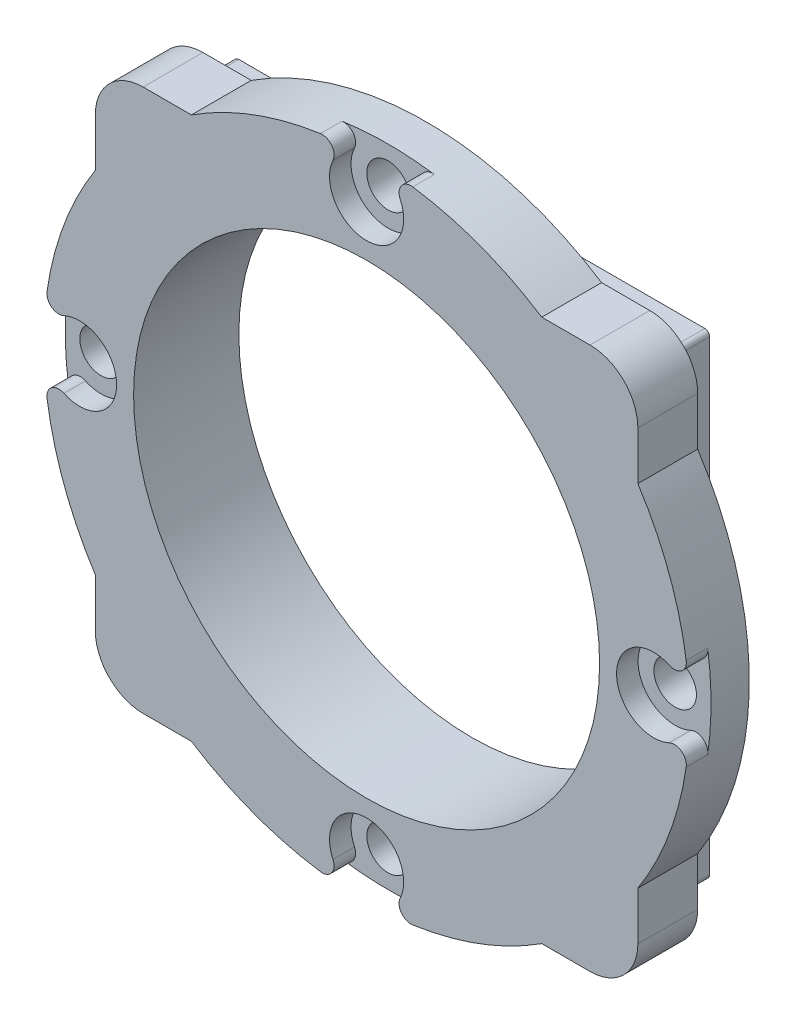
SolidWorks part; units mm, degrees
ref_plane "Front Plane" through (0, 0, 0) normal (0, 0, 1) x (1, 0, 0)
ref_plane "Top Plane" through (0, 0, 0) normal (0, 1, 0) x (1, 0, 0)
ref_plane "Right Plane" through (0, 0, 0) normal (1, 0, 0) x (0, 0, -1)
sketch "Sketch1" plane through (0, 0, 0) normal (0, 0, 1) x (1, 0, 0)
  circle A0 centre (0, 0) radius 12.7
  dimension "D1" = 25.4
extrude "Boss-Extrude1" add sketch "Sketch1" along normal blind 6.35
sketch "Sketch2" plane through (0, 0, 6.35) normal (0, 0, 1) x (1, 0, 0)
  circle A0 centre (0, 0) radius 17.145
  dimension "D1" = 34.29
extrude "Boss-Extrude2" add sketch "Sketch2" along normal blind 44.45
sketch "Sketch3" plane through (0, 0, 50.8) normal (0, 0, 1) x (1, 0, 0)
  circle A0 centre (0, 0) radius 12.5
  dimension "D1" = 25
extrude "Cut-Extrude1" cut sketch "Sketch3" against normal blind 31.75
ref_plane "Plane1" through (0, 25.4, 0) normal (0, 1, 0) x (1, 0, 0)
sketch "Sketch5" plane through (0, 0, 50.8) normal (0, 0, 1) x (1, 0, 0)
  line L1 (-12.625, 12.625) -> (12.625, 12.625)
  line L2 (-12.625, 12.625) -> (-12.625, -12.625)
  line L3 (-12.625, -12.625) -> (12.625, -12.625)
  line L4 (12.625, 12.625) -> (12.625, -12.625)
  line L5 (-12.625, 12.625) -> (12.625, -12.625) construction
  line L6 (-12.625, -12.625) -> (12.625, 12.625) construction
  point P0 (0, 0)
  dimension "D1" = 25.25
  dimension "D2" = 25.25
extrude "Cut-Extrude3" cut sketch "Sketch5" against normal blind 38.1
sketch "Sketch11" plane through (0, 0, 50.8) normal (0, 0, 1) x (1, 0, 0)
  circle A0 centre (0, 0) radius 17.145
extrude "Cut-Extrude5" cut sketch "Sketch11" against normal blind 0.6627
sketch "Sketch10" plane through (12.625, 0, 0) normal (-1, 0, 0) x (0, 0, 1)
  line L0 (19.5664, 12.625) -> (45.9656, -12.625)
  line L1 (12.7, 12.625) -> (50.1373, 12.625) construction
  line L2 (50.1373, -12.625) -> (12.7, -12.625) construction
  line L3 (45.9656, -12.625) -> (18.8617, -12.625)
  line L5 (19.5664, 12.625) -> (12.7, 12.625)
  line L6 (12.7, 12.625) -> (12.7, -12.625)
  line L7 (12.7, -12.625) -> (45.9656, -12.625)
  point P6 (32.766, 0)
  dimension "D1" = 32.766
extrude "Boss-Extrude4" add sketch "Sketch10" along normal up to surface (25.25 mm away) contours L0 M8 M9 M10 | L5 L6 L0 M8 | L6 L7 L3 L0 M10
sketch "Sketch4" plane through (0, 25.4, 0) normal (0, 1, 0) x (1, 0, 0)
  circle A0 centre (0, -33.02) radius 12.5
  dimension "D1" = 25
  dimension "D2" = 33.02
extrude "Cut-Extrude2" cut sketch "Sketch4" against normal blind 13.7012
sketch "Sketch12" plane through (0, 0, 50.1373) normal (0, 0, 1) x (1, 0, 0)
  line L0 (-11.6, 12.625) -> (11.6, 12.625) construction
  line L1 (-14.403, 14.403) -> (14.403, 14.403)
  line L2 (-14.403, 14.403) -> (-14.403, -14.403)
  line L3 (-14.403, -14.403) -> (14.403, -14.403)
  line L4 (14.403, 14.403) -> (14.403, -14.403)
  line L5 (-14.403, 14.403) -> (14.403, -14.403) construction
  line L6 (-14.403, -14.403) -> (14.403, 14.403) construction
  line L8 (-12.625, -12.625) -> (12.625, -12.625)
  line L9 (-12.625, -12.625) -> (-12.625, 12.625)
  line L10 (-12.625, 12.625) -> (12.625, 12.625)
  line L11 (12.625, -12.625) -> (12.625, 12.625)
  line L12 (-12.625, -12.625) -> (12.625, 12.625) construction
  line L13 (-12.625, 12.625) -> (12.625, -12.625) construction
  point P0 (0, 0)
  point P8 (0, 0)
  dimension "D1" = 1.778
  dimension "D2" = 1.778
extrude "Boss-Extrude5" add sketch "Sketch12" against normal blind 33.6318
fillet "Fillet3" radius 2.54 4 edges at (-14.403, -14.403, 33.3214) (14.403, -14.403, 33.3214) (14.403, 14.403, 33.3214) (-14.403, 14.403, 33.3214)
sketch "Sketch6" plane through (0, 0, 0) normal (0, 0, -1) x (-1, 0, 0)
  circle A0 centre (0, 0) radius 9.525
  dimension "D1" = 19.05
combine bodies "Combine1" operation type add bodies to combine 125 121
sketch "Sketch14" plane through (0, 14.403, 0) normal (0, 1, 0) x (1, 0, 0)
  circle A0 centre (0, -33.02) radius 12.5
  dimension "D2" = 25
  dimension "D1" = 33.02
extrude "Cut-Extrude7" cut sketch "Sketch14" against normal up to surface (1.778 mm away)
extrude "Cut-Extrude8" cut sketch "Sketch6" against normal blind 72.644
sketch "Sketch15" plane through (0, 0, 50.1373) normal (0, 0, 1) x (1, 0, 0)
  line L9 (-11.43, 11.43) -> (11.43, 11.43)
  line L10 (-11.43, 11.43) -> (-11.43, -11.43)
  line L11 (-11.43, -11.43) -> (11.43, -11.43)
  line L12 (11.43, 11.43) -> (11.43, -11.43)
  line L13 (-11.43, 11.43) -> (11.43, -11.43) construction
  line L14 (-11.43, -11.43) -> (11.43, 11.43) construction
  point P0 (0, 0)
  dimension "D1" = 22.86
  dimension "D2" = 22.86
extrude "Cut-Extrude9" cut sketch "Sketch15" against normal blind 34.798
fillet "Fillet6" radius 1.27 4 edges at (11.43, 0, 15.3393) (0, -11.43, 15.3393) (-11.43, 0, 15.3393) (0, 11.43, 15.3393)
sketch "Sketch16" plane through (0, 0, 0) normal (0, 0, -1) x (-1, 0, 0)
  circle A0 centre (0, 0) radius 23.7869
extrude "Cut-Extrude10" cut sketch "Sketch16" against normal offset from surface (46.9623 mm away) 3.175
sketch "Sketch17" plane through (0, 0, 50.1373) normal (0, 0, 1) x (1, 0, 0)
  line L11 (12.625, -12.625) -> (-12.625, -12.625)
  line L12 (12.625, -12.625) -> (12.625, 12.625)
  line L13 (12.625, 12.625) -> (-12.625, 12.625)
  line L14 (12.371, -12.371) -> (12.371, 12.371)
  line L15 (-12.371, -12.371) -> (12.371, -12.371)
  line L16 (-12.371, 12.371) -> (-12.371, -12.371)
  line L17 (12.371, 12.371) -> (-12.371, 12.371)
  line L18 (12.371, -12.371) -> (12.371, 12.371)
  line L19 (-12.371, -12.371) -> (12.371, -12.371)
  line L20 (-12.371, 12.371) -> (-12.371, -12.371)
  line L21 (12.371, 12.371) -> (-12.371, 12.371)
  line L22 (-12.625, -12.625) -> (-12.625, 12.625)
  line L23 (12.625, -12.625) -> (-12.625, 12.625) construction
  line L24 (12.625, 12.625) -> (-12.625, -12.625) construction
  point P0 (0, 0)
  dimension "D1" = 0.254
extrude "Boss-Extrude6" add sketch "Sketch17" against normal offset from surface (5.588 mm away) 2.413 separate body
combine bodies "Combine2" operation type add bodies to combine 129 130
fillet "Fillet7" radius 0.254 4 edges at (12.625, -12.625, 45.7558) (-12.625, -12.625, 45.7558) (-12.625, 12.625, 45.7558) (12.625, 12.625, 45.7558)
hole_wizard "#2 Clearance Hole1" positions "Sketch22" profile "Sketch23" hole size "#2" standard "ANSI Inch"
sketch "Sketch22" plane through (0, 0, 50.1373) normal (0, 0, 1) x (1, 0, 0)
  point P0 (0, 15.24)
  point P2 (15.24, 0)
  point P4 (0, -15.24)
  point P6 (-15.24, 0)
  dimension "D1" = 15.24
  dimension "D2" = 15.24
  dimension "D3" = 15.24
  dimension "D4" = 15.24
sketch "Sketch23" plane through (0, 15.24, 50.1373) normal (1, 0, 0) x (0, -1, 0)
  line L0 (0, 0) -> (0, 13.3792)
  line L1 (0, 13.3792) -> (1.1303, 12.7)
  line L2 (1.1303, 12.7) -> (1.1303, 0)
  line L5 (1.1303, 0) -> (0, 0)
  line L10 (0, 13.3792) -> (-1.1303, 12.7) construction
  line L11 (0, -6.35) -> (0, 107.95) construction
  dimension "Hole Dia." = 2.2606
  dimension "Hole Depth" = 12.7
  dimension "Drill Angle" = 118
sketch "Sketch24" plane through (0, 0, 50.1373) normal (0, 0, 1) x (1, 0, 0)
  line L1 (-12.6238, 12.7153) -> (12.6238, 12.7153)
  line L2 (-12.6238, 12.7153) -> (-12.6238, -12.7153)
  line L3 (-12.6238, -12.7153) -> (12.6238, -12.7153)
  line L4 (12.6238, 12.7153) -> (12.6238, -12.7153)
  line L5 (-12.6238, 12.7153) -> (12.6238, -12.7153) construction
  line L6 (-12.6238, -12.7153) -> (12.6238, 12.7153) construction
  circle A0 centre (0, 0) radius 12.6238
  dimension "D1" = 25.2476
  dimension "D2" = 25.2476
extrude "Boss-Extrude7" add sketch "Sketch24" against normal up to surface (5.588 mm away) contours A0 M23 M22 | A0 M24 M23 | A0 M21 M24 | A0 M22 M21 | L2 L1 L4 L3
sketch "Sketch25" plane through (0, 0, 50.1373) normal (0, 0, 1) x (1, 0, 0)
  circle A0 centre (0, 15.24) radius 1.9685
  dimension "D1" = 3.937
extrude "Cut-Extrude12" cut sketch "Sketch25" against normal blind 1.143
fillet "Fillet8" radius 0.635 2 edges at (-0.526, 17.1369, 49.5658) (0.526, 17.1369, 49.5658)
pattern_circular "CirPattern1" count 4 over 360 about axis through (0, 0, 0) along (0, 0, 1) of "Cut-Extrude12", "Fillet8"
sketch "Sketch26" plane through (0, 0, 50.1373) normal (0, 0, 1) x (1, 0, 0)
  line L1 (-12.3988, 12.3838) -> (12.3988, 12.3838)
  line L2 (-12.3988, 12.3838) -> (-12.3988, -12.3838)
  line L3 (-12.3988, -12.3838) -> (12.3988, -12.3838)
  line L4 (12.3988, 12.3838) -> (12.3988, -12.3838)
  line L5 (-12.3988, 12.3838) -> (12.3988, -12.3838) construction
  line L6 (-12.3988, -12.3838) -> (12.3988, 12.3838) construction
  circle A0 centre (0, 0) radius 12.371
extrude "Boss-Extrude8" add sketch "Sketch26" against normal up to surface (5.588 mm away)
